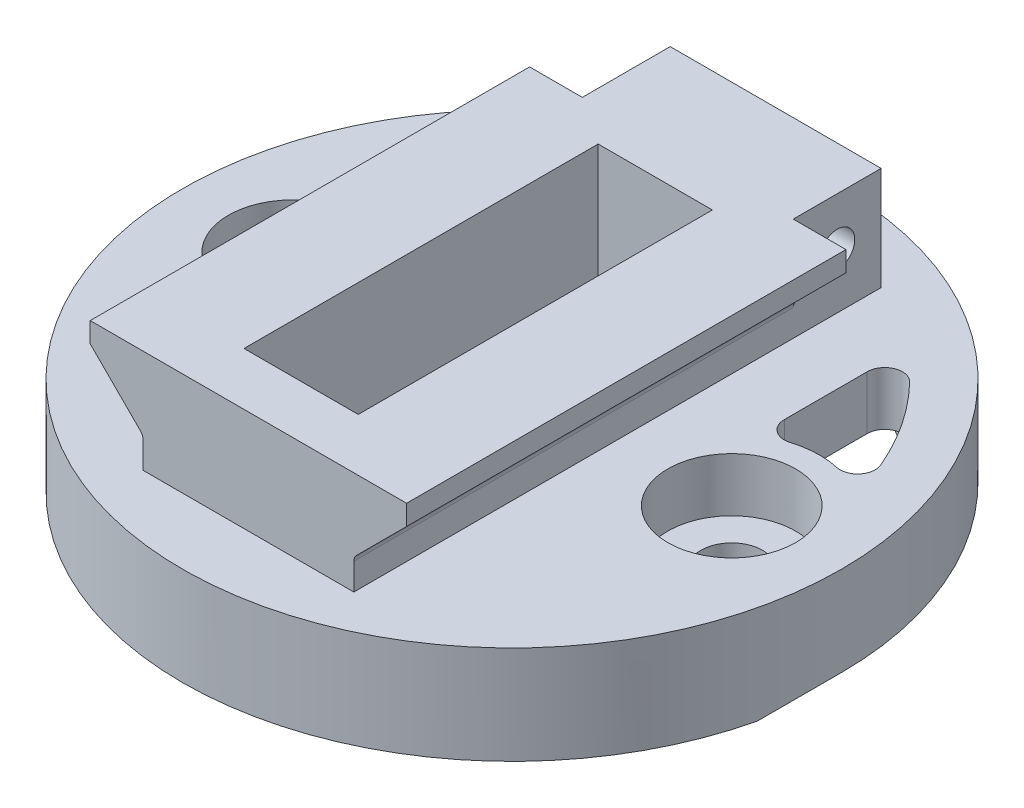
SolidWorks part; units mm, degrees
other "<dovetail_male>-<Contouring>"
ref_plane "Front Plane" through (0, 0, 0) normal (0, 0, 1) x (1, 0, 0)
ref_plane "Top Plane" through (0, 0, 0) normal (0, 1, 0) x (1, 0, 0)
ref_plane "Right Plane" through (0, 0, 0) normal (1, 0, 0) x (0, 0, -1)
sketch "Sketch1-dovetail_male" plane through (0, 0, 0) normal (0, 0, 1) x (1, 0, 0)
  line L0 (0, 0) -> (0, 12) construction
  line L1 (-18.5, 12) -> (-18.5, 9)
  line L2 (-18.5, 9) -> (-12.5, 3)
  line L3 (-12.5, 3) -> (-12.5, 0)
  line L4 (12.5, 3) -> (12.5, 0)
  line L5 (18.5, 9) -> (12.5, 3)
  line L6 (18.5, 12) -> (18.5, 9)
  line L7 (-18.5, 12) -> (18.5, 12)
  line L8 (-12.5, 0) -> (12.5, 0)
  dimension "D1" = 12
  dimension "D2" = 3
  dimension "D3" = 45
  dimension "D4" = 25
sketch "Sketch9-dovetail_male" plane through (0, 0, -30) normal (0, 0, -1) x (-1, 0, 0)
  line L0 (0, 12) -> (0, 0) construction
  line L1 (-18.5, 12) -> (-12.5, 12)
  line L2 (-18.5, 12) -> (-18.5, 0)
  line L3 (-18.5, 0) -> (-12.5, 0)
  line L4 (-12.5, 12) -> (-12.5, 0)
  line L7 (12.5, 12) -> (12.5, 0)
  line L8 (18.5, 0) -> (12.5, 0)
  line L9 (18.5, 12) -> (18.5, 0)
  line L10 (18.5, 12) -> (12.5, 12)
sketch "Sketch10-dovetail_male" plane through (12.5, 0, 0) normal (1, 0, 0) x (0, 0, -1)
  line L0 (25, 12) -> (25, 0) construction
  circle A0 centre (25, 6) radius 2.7
  dimension "4" = 5.4
sketch "Sketch11-dovetail_male" plane through (0, 0, 0) normal (0, -1, 0) x (1, 0, 0)
  line L0 (0, -16.3) -> (0, 0) construction
  line L1 (6.5, -16.3) -> (-6.5, -16.3)
  line L2 (6.5, -16.3) -> (6.5, 24)
  line L3 (6.5, 24) -> (-6.5, 24)
  line L4 (-6.5, -16.3) -> (-6.5, 24)
  line L8 (12.5, -27.7) -> (12.5, -22.3) construction
  dimension "D3" = 6
inserted part "dovetail_male"
sketch "Sketch5" plane through (0, 0, 0) normal (0, -1, 0) x (1, 0, 0)
  circle A0 centre (0, 0) radius 37.5
  dimension "D1" = 75
extrude "UR Wrist Body" add sketch "Sketch5" along normal blind 1.5
sketch "Sketch6" plane through (0, -1.5, 0) normal (0, -1, 0) x (1, 0, 0)
  line L0 (25, 0) -> (0, 0) construction
  line L1 (0, 0) -> (0, 25) construction
  line L2 (0, 25) -> (17.6777, 17.6777) construction
  line L3 (17.6777, 17.6777) -> (25, 0) construction
  line L4 (17.6777, 17.6777) -> (0, 0) construction
  circle A0 centre (0, 0) radius 25 construction
  circle A1 centre (17.6777, 17.6777) radius 0.5 construction
  circle A2 centre (-17.6777, 17.6777) radius 0.5 construction
  circle A3 centre (-17.6777, -17.6777) radius 0.5 construction
  circle A4 centre (17.6777, -17.6777) radius 0.5 construction
  circle A5 centre (25, 0) radius 0.5
  circle A6 centre (-25, 0) radius 0.5
  dimension "D1" = 50
  dimension "D2" = 1
  dimension "D3" = 1
extrude "Cut-Extrude1" cut sketch "Sketch6" against normal through all
sketch "Sketch16" plane through (0, -1.5, 0) normal (0, -1, 0) x (1, 0, 0)
  circle A0 centre (0, 0) radius 37.5
  circle A1 centre (0, 0) radius 37.5 construction
extrude "Boss-Extrude2" add sketch "Sketch16" along normal offset from surface (9.93 mm away) 11.43
sketch "Sketch26" plane through (0, 0, 0) normal (0, 1, 0) x (1, 0, 0)
  line L1 (-37.5, 0) -> (37.5, 0)
  line L2 (-37.5, 0) -> (-37.5, -60)
  line L3 (-37.5, -60) -> (37.5, -60)
  line L4 (37.5, 0) -> (37.5, -60)
  circle A0 centre (0, 0) radius 37.5 construction
  dimension "D1" = 60
extrude "Boss-Extrude4" add sketch "Sketch26" against normal up to surface (11.43 mm away)
hole_wizard "CBORE for M6 Hex Head Bolt1" positions "Sketch8" profile "Sketch7" counterbore size "M6" standard "ANSI Metric"
sketch "Sketch8" plane through (0, 0, 0) normal (0, 1, 0) x (1, 0, 0)
  point P15 (-25, 0)
  point P18 (25, 0)
sketch "Sketch7" plane through (-25, 0, 0) normal (1, 0, 0) x (0, 0, 1)
  line L0 (0, 0) -> (0, 11.43)
  line L1 (0, 11.43) -> (3.5, 11.43)
  line L3 (3.5, 11.43) -> (3.5, 6.38)
  line L4 (3.5, 6.38) -> (7.275, 6.38)
  line L5 (7.275, 6.38) -> (7.275, 0)
  line L7 (7.275, 0) -> (0, 0)
  line L11 (0, -6.35) -> (0, 107.95) construction
  dimension "Thru Hole Dia." = 7
  dimension "Thru Hole Depth" = 11.43
  dimension "C'Bore Dia." = 14.55
  dimension "C'Bore Depth" = 6.38
sketch "Sketch22" plane through (0, -11.43, 0) normal (0, -1, 0) x (1, 0, 0)
  line L0 (32.5, 18.7083) -> (32.5, 55)
  line L1 (32.5, 55) -> (5, 55)
  line L2 (-32.5, 55) -> (-32.5, 18.7083)
  line L3 (32.5, 55) -> (37.5, 55) construction
  line L4 (37.5, 60) -> (37.5, 0) construction
  line L5 (32.5, 55) -> (32.5, 60) construction
  line L6 (-37.5, 60) -> (37.5, 60) construction
  line L7 (0, 37.1652) -> (0, 55) construction
  line L8 (5, 37.1652) -> (5, 55)
  line L9 (-5, 37.1652) -> (-5, 55)
  line L10 (-5, 55) -> (-32.5, 55)
  arc A0 (30.98, 8.015) -> (30.98, -8.015) centre (25, 0) ccw
  arc A1 (-30.98, -8.015) -> (-30.98, 8.015) centre (-25, 0) ccw
  arc A2 (30.98, 8.015) -> (-30.98, 8.015) centre (0, 0) ccw
  arc A3 (-30.98, -8.015) -> (30.98, -8.015) centre (0, 0) ccw
  arc A4 (32.5, 18.7083) -> (5, 37.1652) centre (0, 0) ccw
  arc A5 (-5, 37.1652) -> (-32.5, 18.7083) centre (0, 0) ccw
  dimension "D1" = 20
  dimension "D2" = 64
  dimension "D3" = 75
  dimension "D6" = 5
  dimension "D4" = 5
  dimension "D5" = 5
extrude "Cut-Extrude7" cut sketch "Sketch22" against normal blind 5.08
sketch "Sketch13" plane through (0, 0, 0) normal (0, 1, 0) x (1, 0, 0)
  line L5 (-6.5, -24) -> (6.5, -24)
  line L6 (6.5, -24) -> (6.5, 16.3)
  line L7 (6.5, 16.3) -> (-6.5, 16.3)
  line L8 (-6.5, 16.3) -> (-6.5, -24)
  line L9 (-6.5, -24) -> (6.5, -24)
  line L10 (6.5, -24) -> (6.5, 16.3)
  line L11 (6.5, 16.3) -> (-6.5, 16.3)
  line L12 (-6.5, 16.3) -> (-6.5, -24)
  dimension "D1" = 0
extrude "Clearance Continuation" cut sketch "Sketch13" against normal through all
fillet "Fillet3" radius 0.5 13 edges at (0, 12, -30) (18.3536, 12, -19.8536) (12.3536, 12, -29.8536) (-12.3536, 12, -29.8536) (-18.3536, 12, -19.8536) (12.6464, 12, -20.1464) (-12.6464, 12, -20.1464) (18.5, 12, 5.25) (-18.5, 12, 5.25) (15.5, 12, -20) (12.5, 12, -25) (-15.5, 12, -20) (-12.5, 12, -25)
sketch "Sketch17" plane through (0, 0, 0) normal (0, 1, 0) x (1, 0, 0)
  line L1 (0, 12.776) -> (0, -13.7719) construction
  line L2 (-5.4086, 0) -> (7.0863, 0) construction
  line L3 (-19.5, 8.3516) -> (-19.5, 25.3722)
  line L4 (-12.5, -30) -> (-12.5, 29.5) construction
  arc A0 (-19.5, 25.3722) -> (-30.98, 8.015) centre (0, 0) ccw
  arc A1 (30.98, 8.015) -> (-30.98, 8.015) centre (0, 0) ccw construction
  arc A2 (-19.5, 8.3516) -> (-30.98, 8.015) centre (-25, 0) ccw
  arc A3 (-30.98, -8.015) -> (-30.98, 8.015) centre (-25, 0) ccw construction
  dimension "D2" = 7
extrude "Cut-Extrude2" cut sketch "Sketch17" against normal through all
fillet "Fillet4" radius 2 3 edges at (-30.98, -5.715, -8.015) (-19.5, -3.175, -8.3516) (-19.5, -3.175, -25.3722)
mirror "Mirror2" about plane through (0, 0, 0) normal (1, 0, 0) of "Fillet4", "Cut-Extrude2"
sketch "Sketch18" plane through (12.5, 0, 0) normal (1, 0, 0) x (0, 0, -1)
  circle A0 centre (25, 6) radius 2
  circle A1 centre (25, 6) radius 3
  dimension "D1" = 4
  dimension "D2" = 6
extrude "Boss-Extrude3" add sketch "Sketch18" against normal up to surface (25 mm away)
sketch "Sketch19" plane through (0, 0, 0) normal (0, 0, 1) x (1, 0, 0)
  line L13 (-12, 0.5) -> (-12, -0.25)
  line L14 (-12, -0.25) -> (-41.8538, -0.25)
  line L15 (-41.8538, -0.25) -> (-41.8538, 17.9915)
  line L16 (-41.8538, 17.9915) -> (46.2765, 17.9915)
  line L17 (46.2765, 17.9915) -> (46.2765, -0.25)
  line L18 (46.2765, -0.25) -> (12, -0.25)
  line L19 (12, -0.25) -> (12, 0.5)
  line L20 (37.5, 0) -> (-37.5, 0) construction
  line L25 (18, 11.5) -> (-18, 11.5)
  line L26 (-18, 11.5) -> (-18, 9.2071)
  line L27 (-18, 9.2071) -> (-12.2929, 3.5)
  line L28 (-12, 2.7929) -> (-12, 0.5)
  line L29 (-12, 0.5) -> (12, 0.5)
  line L34 (12, 0.5) -> (12, 2.7929)
  line L35 (12.2929, 3.5) -> (18, 9.2071)
  line L36 (18, 9.2071) -> (18, 11.5)
  line L37 (18, 11.5) -> (-18, 11.5)
  line L38 (-18, 11.5) -> (-18, 9.2071)
  line L39 (-18, 9.2071) -> (-12.2929, 3.5)
  line L40 (-12, 2.7929) -> (-12, 0.5)
  line L46 (12, 0.5) -> (12, 2.7929)
  line L47 (12.2929, 3.5) -> (18, 9.2071)
  line L48 (18, 9.2071) -> (18, 11.5)
  arc A14 (-12, 2.7929) -> (-12.2929, 3.5) centre (-13, 2.7929) ccw
  arc A15 (12.2929, 3.5) -> (12, 2.7929) centre (13, 2.7929) ccw
  arc A20 (-12, 2.7929) -> (-12.2929, 3.5) centre (-13, 2.7929) ccw
  arc A21 (12.2929, 3.5) -> (12, 2.7929) centre (13, 2.7929) ccw
  dimension "D2" = 0.25
  dimension "D1" = 0.5
extrude "Cut-Extrude3" cut sketch "Sketch19" against normal through all both and the other way through all
sketch "Sketch20" plane through (0, 0, 0) normal (0, 1, 0) x (1, 0, 0)
  line L0 (-12, 30) -> (13.1672, 30)
  line L1 (-12, 35.5282) -> (-12, 30) construction
  line L2 (13.1672, 30) -> (13.1672, 40.874)
  line L3 (13.1672, 40.874) -> (-13.6423, 40.874)
  line L4 (-13.6423, 40.874) -> (-12, 30)
  line L8 (-12, 30) -> (12, 30) construction
  line L9 (16.047, -54.6038) -> (15.4806, -30)
  line L10 (15.4806, -30) -> (-15.5069, -30)
  line L11 (-15.5069, -30) -> (-15.5069, -92.5118)
  line L12 (-15.5069, -92.5118) -> (15.0938, -93.6994)
  line L13 (-12, -30) -> (12, -30) construction
extrude "Cut-Extrude4" cut sketch "Sketch20" against normal up to surface (0.25 mm away)
fillet "Fillet6" radius 12.5 2 edges at (-37.5, -5.84, 60) (37.5, -5.84, 60)
chamfer "Chamfer1" distance 1 angle 45 6 edges at (0, -11.43, -37.5) (-37.5, -11.43, 23.75) (37.5, -11.43, 23.75) (0, -11.43, 60) (-33.8388, -11.43, 56.3388) (33.8388, -11.43, 56.3388)
sketch "Sketch23" plane through (0, 11.5, 0) normal (0, 1, 0) x (1, 0, 0)
  line L0 (12, 30) -> (-12, 30) construction
  line L1 (12, 30) -> (14.133, 30)
  line L2 (12, 30) -> (12, 20)
  line L3 (12, 20) -> (14.133, 20)
  line L4 (14.133, 30) -> (14.133, 20)
  line L5 (18, 20) -> (13, 20) construction
  line L6 (0, 30) -> (0, 7.83) construction
  line L7 (-12, 30) -> (-14.133, 30)
  line L8 (-14.133, 30) -> (-14.133, 20)
  line L9 (-12, 20) -> (-14.133, 20)
  line L10 (-12, 30) -> (-12, 20)
extrude "Cut-Extrude8" cut sketch "Sketch23" against normal up to surface (11.75 mm away)
sketch "Sketch27" plane through (0, -0.25, 0) normal (0, 1, 0) x (1, 0, 0)
  line L0 (-37.5, -39.8425) -> (-27.305, -39.8425) construction
  line L1 (-37.5, 0) -> (-37.5, -47.5) construction
  line L2 (-27.305, -39.8425) -> (-27.305, -51.8425) construction
  line L3 (-37.5, -42.065) -> (-29.5275, -42.065)
  line L4 (-29.5275, -42.065) -> (-29.21, -47.8425)
  line L5 (-37.5, -37.62) -> (-25.0825, -37.62)
  line L6 (-29.21, -47.8425) -> (-29.21, -51.8425)
  line L7 (-29.5275, -42.065) -> (-29.5275, -42.2306) construction
  line L8 (-25.0825, -37.62) -> (-25.0825, -42.2306) construction
  line L9 (-29.21, -51.8425) -> (-25.4, -51.8425)
  line L10 (-25.4, -51.8425) -> (-25.4, -47.8425)
  line L11 (-25.4, -47.8425) -> (-25.0825, -37.62)
  line L12 (-37.5, -37.62) -> (-37.5, -42.065)
  line L13 (0, 0) -> (0, -76.2012) construction
  line L14 (27.305, -39.8425) -> (27.305, -51.8425) construction
  line L15 (37.5, -39.8425) -> (27.305, -39.8425) construction
  line L16 (37.5, -37.62) -> (37.5, -42.065)
  line L17 (25.4, -47.8425) -> (25.0825, -37.62)
  line L18 (25.4, -51.8425) -> (25.4, -47.8425)
  line L19 (29.21, -51.8425) -> (25.4, -51.8425)
  line L20 (29.21, -47.8425) -> (29.21, -51.8425)
  line L21 (37.5, -37.62) -> (25.0825, -37.62)
  line L22 (29.5275, -42.065) -> (29.21, -47.8425)
  line L23 (37.5, -42.065) -> (29.5275, -42.065)
  line L24 (-27.305, -39.8425) -> (-27.305, -42.2306) construction
  line L25 (12, -30) -> (-12, -30) construction
  point P11 (-27.305, -51.8425)
  dimension "D3" = 3.81
  dimension "D4" = 4
  dimension "D5" = 12
  dimension "D6" = 7.62
  dimension "D7" = 50.8
  dimension "D1" = 2.2225
  dimension "D2" = 2.2225
extrude "Cut-Extrude10" cut sketch "Sketch27" against normal through all
fillet "Fillet7" radius 1.905 12 edges at (29.5275, -3.3, 42.065) (37.5, -5.34, 42.065) (37.5, -5.34, 37.62) (25.0825, -3.3, 37.62) (-37.5, -5.34, 42.065) (-29.5275, -3.3, 42.065) (-25.0825, -3.3, 37.62) (-37.5, -5.34, 37.62) (29.21, -3.3, 51.8425) (25.4, -3.3, 51.8425) (-25.4, -3.3, 51.8425) (-29.21, -3.3, 51.8425)
sketch "Sketch29" plane through (0, -11.43, 0) normal (0, -1, 0) x (1, 0, 0)
  line L11 (37.5, 0) -> (37.5, 100.5091)
  line L13 (-37.5, 0) -> (-37.5, 100.5091)
  line L14 (-37.5, 100.5091) -> (37.5, 100.5091)
  arc A2 (37.5, 0) -> (-37.5, 0) centre (0, 0) ccw
extrude "Cut-Extrude12" cut sketch "Sketch29" against normal through all
ref_plane "Plane1" through (0, -11.43, 0) normal (0, -1, 0) x (-1, 0, 0)
sketch "Sketch30" plane through (0, -11.43, 0) normal (0, -1, 0) x (-1, 0, 0)
  circle A0 centre (0, 0) radius 36.5
equation "\"D1\"= \"width keep@dovetail_male.sldprt\""
